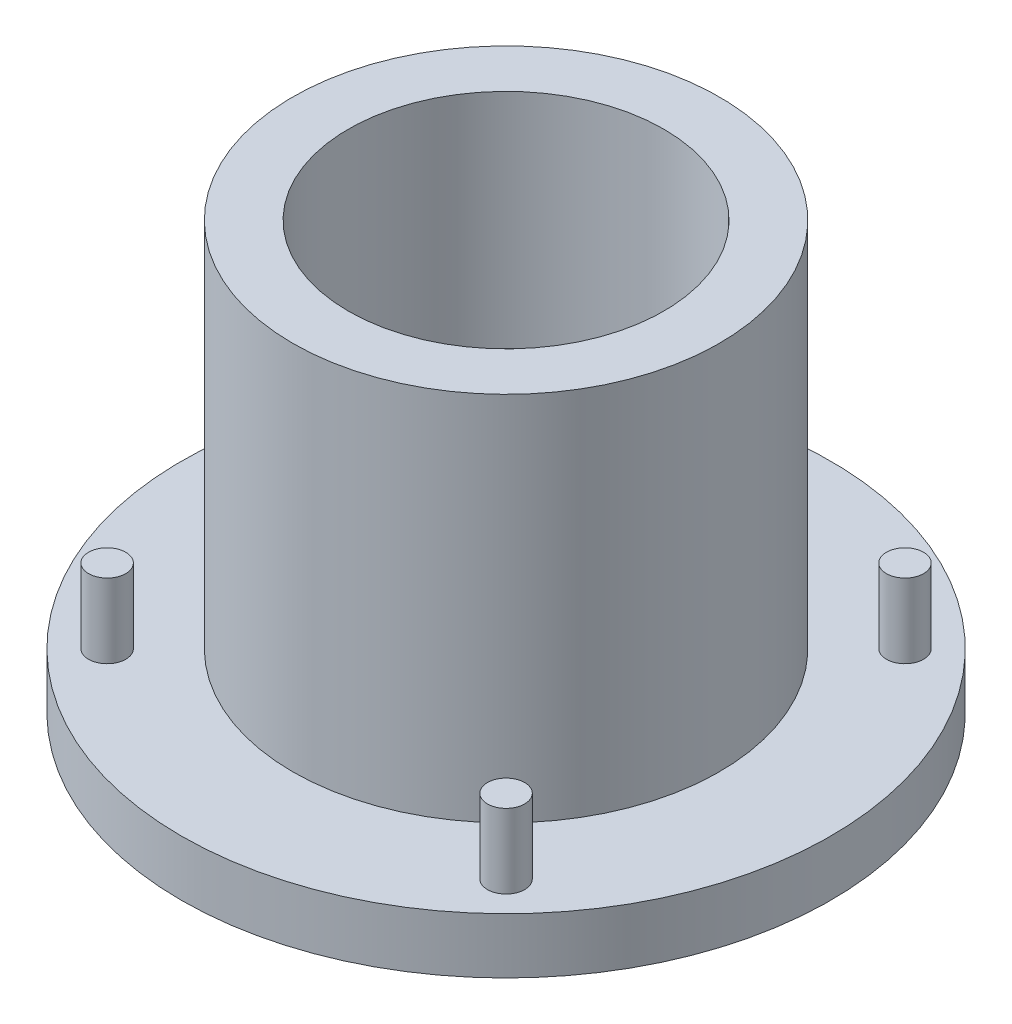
SolidWorks part; units mm, degrees
ref_plane "Front Plane" through (0, 0, 0) normal (0, 0, 1) x (1, 0, 0)
ref_plane "Top Plane" through (0, 0, 0) normal (0, 1, 0) x (1, 0, 0)
ref_plane "Right Plane" through (0, 0, 0) normal (1, 0, 0) x (0, 0, -1)
sketch "Sketch1" plane through (0, 0, 0) normal (0, 1, 0) x (1, 0, 0)
  line L1 (-10.75, 10.75) -> (10.75, 10.75) construction
  line L2 (-10.75, 10.75) -> (-10.75, -10.75) construction
  line L3 (-10.75, -10.75) -> (10.75, -10.75) construction
  line L4 (10.75, 10.75) -> (10.75, -10.75) construction
  line L5 (-10.75, 10.75) -> (10.75, -10.75) construction
  line L6 (-10.75, -10.75) -> (10.75, 10.75) construction
  circle A0 centre (0, 0) radius 17.5
  circle A1 centre (0, 0) radius 9.5
  circle A2 centre (10.75, -10.75) radius 1
  circle A3 centre (-10.75, -10.75) radius 1
  circle A4 centre (10.75, 10.75) radius 1
  circle A5 centre (-10.75, 10.75) radius 1
extrude "Boss-Extrude2" add sketch "Sketch1" against normal blind 3 contours A0
sketch "Sketch2" plane through (0, 0, 0) normal (0, 1, 0) x (1, 0, 0)
  line L1 (-10.75, 10.75) -> (10.75, 10.75) construction
  line L2 (-10.75, 10.75) -> (-10.75, -10.75) construction
  line L3 (-10.75, -10.75) -> (10.75, -10.75) construction
  line L4 (10.75, 10.75) -> (10.75, -10.75) construction
  line L5 (-10.75, 10.75) -> (10.75, -10.75) construction
  line L6 (-10.75, -10.75) -> (10.75, 10.75) construction
  circle A0 centre (-10.75, -10.75) radius 1
  circle A1 centre (-10.75, 10.75) radius 1
  circle A2 centre (10.75, 10.75) radius 1
  circle A3 centre (10.75, -10.75) radius 1
  point P0 (0, 0)
extrude "Boss-Extrude3" add sketch "Sketch2" along normal blind 4
sketch "Sketch3" plane through (0, 0, 0) normal (0, 1, 0) x (1, 0, 0)
  circle A0 centre (0, 0) radius 11.5
  circle A1 centre (0, 0) radius 8.5
extrude "Boss-Extrude4" add sketch "Sketch3" along normal blind 20
sketch "Sketch4" plane through (0, 0, 0) normal (0, 1, 0) x (1, 0, 0)
  circle A0 centre (0, 0) radius 9.5
extrude "Boss-Extrude5" add sketch "Sketch4" along normal blind 8
sketch "Sketch5" plane through (0, 8, 0) normal (0, 1, 0) x (1, 0, 0)
  circle A0 centre (0, 0) radius 2.25
extrude "Cut-Extrude1" cut sketch "Sketch5" against normal through all
